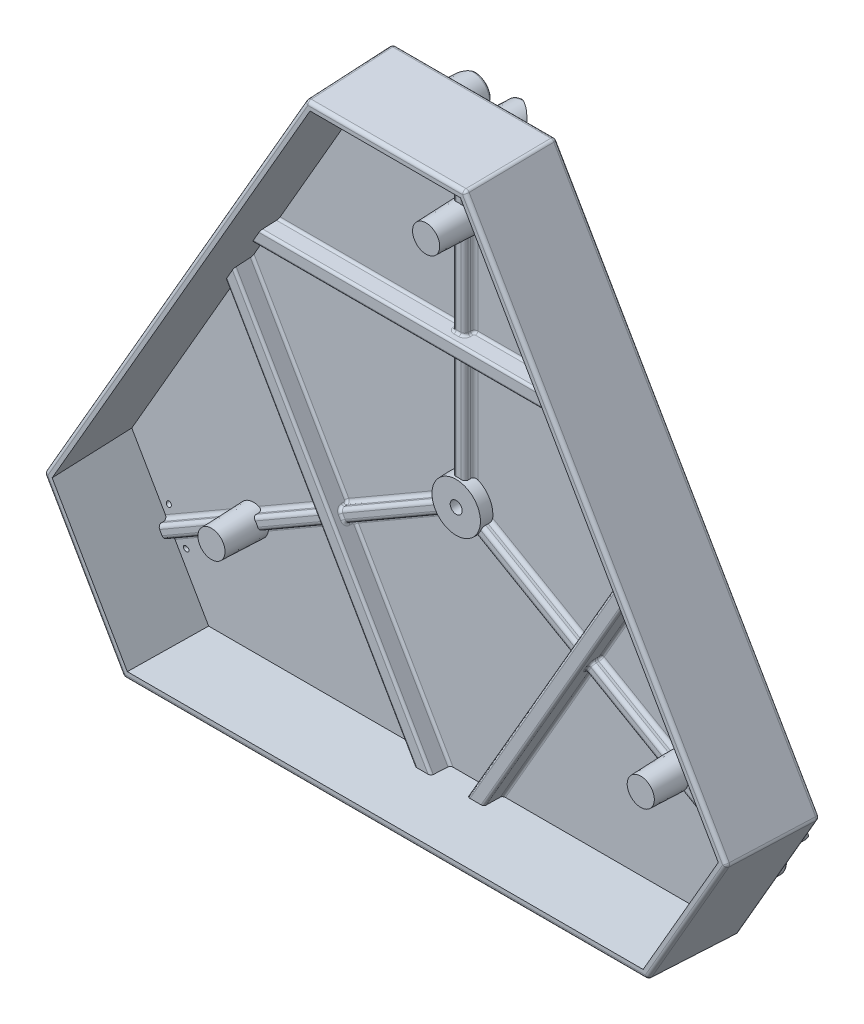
SolidWorks part; units mm, degrees
ref_plane "Plane1" through (0, 0, 0) normal (0, 0, 1) x (1, 0, 0)
ref_plane "Plane2" through (0, 0, 0) normal (0, 1, 0) x (1, 0, 0)
ref_plane "Plane3" through (0, 0, 0) normal (1, 0, 0) x (0, 0, -1)
sketch "Esquisse1" plane through (0, 0, 0) normal (0, 0, 1) x (1, 0, 0)
  line L0 (0, 0) -> (0, 320) construction
  line L1 (0, 0) -> (72.3, 313.1656) construction
  line L2 (67.4853, 292.311) -> (-67.4853, 292.311)
  line L3 (0, 0) -> (-312.2499, -180.2776) construction
  line L4 (0, 0) -> (321.4809, -185.6071) construction
  line L5 (-67.4853, 292.311) -> (-286.8914, -87.7115)
  line L6 (-219.4061, -204.5995) -> (219.4061, -204.5995)
  line L7 (0, 0) -> (-348.1002, -106.4249) construction
  line L8 (-286.8914, -87.7115) -> (-219.4061, -204.5995)
  line L9 (0, 0) -> (259.3987, -241.8932) construction
  line L10 (219.4061, -204.5995) -> (286.8914, -87.7115)
  line L11 (286.8914, -87.7115) -> (67.4853, 292.311)
  point P8 (0, 292.311)
  point P16 (253.1488, -146.1555)
  point P17 (-253.1488, -146.1555)
  dimension "D2" = 13
  dimension "D3" = 120
  dimension "D4" = 120
  dimension "D5" = 13
  dimension "D6" = 13
extrude "Base-Extrusion" add sketch "Esquisse1" along normal blind 75 draft 2
shell "Coque1" thickness 6
fillet "Congé1" radius 3
fillet "Congé2" radius 3
fillet "Congé3" radius 3
fillet "Congé4" radius 3
fillet "Congé5" radius 3
fillet "Congé6" radius 3
fillet "Congé7" radius 3
sketch "Esquisse2" plane through (0, 0, 0) normal (0, 0, -1) x (-1, 0, 0)
  circle A0 centre (0, 0) radius 60
  dimension "D1" = 120
extrude "Boss.-Extru.1" add sketch "Esquisse2" along normal blind 3
sketch "Esquisse3" plane through (0, 0, -3) normal (0, 0, -1) x (-1, 0, 0)
  circle A0 centre (0, 0) radius 5
  dimension "D1" = 10
extrude "Enlèv. mat.-Extru.1" cut sketch "Esquisse3" against normal through all
fillet "Congé8" radius 2
sketch "Esquisse4" plane through (0, 0, 6) normal (0, 0, 1) x (1, 0, 0)
  circle A0 centre (0, 0) radius 20.5
  dimension "D1" = 41
extrude "Boss.-Extru.2" add sketch "Esquisse4" along normal blind 10 draft 2
sketch "Esquisse8" plane through (0, 0, 0) normal (0, 1, 0) x (1, 0, 0)
  line L0 (0, -40) -> (0, 10) construction
  line L1 (-5, -4) -> (-5, -14)
  line L2 (-5, -14) -> (5, -14)
  line L3 (-5, -4) -> (5, -4)
  line L4 (0, 0) -> (-11.1536, 0) construction
  line L5 (5, -4) -> (5, -14)
  point P11 (0, -4)
  point P12 (0, -14)
  dimension "D1" = 10
  dimension "D2" = 5
  dimension "D3" = 4
extrude "Boss.-Extru.3" add sketch "Esquisse8" along normal up to surface (286.1677 mm away)
fillet "Congé10" radius 3
fillet "Congé11" radius 3
sketch "Esquisse9" plane through (0, 0, 6) normal (0, 0, 1) x (1, 0, 0)
  line L0 (0, 0) -> (0, 354.9713) construction
  circle A0 centre (0, 206.069) radius 12.5
  dimension "D1" = 25
extrude "Boss.-Extru.4" add sketch "Esquisse9" along normal blind 35 draft 2
sketch "Esquisse11" plane through (0, 0, 16) normal (0, 0, 1) x (1, 0, 0)
  circle A0 centre (0, 0) radius 5
  dimension "D1" = 10
extrude "Enlèv. mat.-Extru.3" cut sketch "Esquisse11" against normal through all
pattern_circular "Répétition circulaire3" count 3 every 120
sketch "Esquisse12" plane through (0, 0, 0) normal (0, 0, -1) x (-1, 0, 0)
  line L0 (0, 0) -> (0, 310.808) construction
  line L1 (0, 0) -> (22.319, 300.3379) construction
  circle A0 centre (20.2502, 272.5) radius 14.5
  dimension "D2" = 29
  dimension "D1" = 4.25
  dimension "D3" = 272.5
extrude "Boss.-Extru.5" add sketch "Esquisse12" along normal blind 20 draft 2
fillet "Congé12" radius 2
mirror "Symétrie1" about plane through (0, 0, 0) normal (1, 0, 0)
pattern_circular "Répétition circulaire5" count 3 every 120
sketch "Esquisse13" plane through (0, 0, -20) normal (0, 0, -1) x (-1, 0, 0)
  point P0 (20.2502, 272.5)
ref_plane "Plan2" through (-20.2502, 0, 0) normal (1, 0, 0) x (0, 0, -1)
ref_plane "Plan3" through (-146.632, 130.5525, 0) normal (0.7469, -0.665, 0) x (0, 0, -1)
sketch "Esquisse14" plane through (-146.632, 130.5525, 0) normal (0.7469, -0.665, 0) x (0, 0, -1)
  line L0 (20, 190.0564) -> (49.6136, 190.0564) construction
  line L1 (20, 190.0564) -> (20, 153.0726) construction
  line L2 (0, 172.3152) -> (0, 157.2567) construction
  line L3 (1.9302, 190.0564) -> (18.0698, 190.0564) construction
  line L4 (10.4, 187.6689) -> (10.4, 153.0726) construction
  line L5 (25.7569, 210.3405) -> (0.5202, 173.0832)
  line L6 (25.7569, 210.3405) -> (59.5454, 187.4534)
  line L7 (59.5454, 187.4534) -> (34.3087, 150.1961)
  line L8 (34.3087, 150.1961) -> (0.5202, 173.0832)
  line L9 (10.4, 187.6689) -> (37.659, 171.9308) construction
  point P13 (10.4, 187.6689)
  point P15 (12.5, 190.0564)
  point P18 (37.659, 171.9308)
  dimension "D1" = 10.4
  dimension "D2" = 12.5
  dimension "D3" = 30
  dimension "D4" = 40.8103
  dimension "D5" = 45
extrude "Enlèv. mat.-Extru.4" cut sketch "Esquisse14" against normal mid plane 30
sketch "Esquisse16" plane through (-146.632, 130.5525, 0) normal (0.7469, -0.665, 0) x (0, 0, -1)
  line L0 (17.0167, 197.4953) -> (3.4439, 177.4617) construction
  line L1 (-2.3946, 196.4428) -> (13.8546, 185.4339) construction
  point P5 (10.4211, 187.7601)
sketch "Esquisse17" plane through (36.0385, 40.4772, 80.0098) normal (-0.3729, -0.4189, -0.8279) x (-0.9279, 0.1683, 0.3328)
  circle A0 centre (62.3243, 246.3286) radius 10
  dimension "D1" = 20
extrude "Enlèv. mat.-Extru.5" cut sketch "Esquisse17" against normal blind 8
sketch "Esquisse18" plane through (39.0219, 43.828, 86.6333) normal (-0.3729, -0.4189, -0.8279) x (-0.9279, 0.1683, 0.3328)
  circle A0 centre (62.3243, 246.3286) radius 2
  dimension "D1" = 4
extrude "Enlèv. mat.-Extru.6" cut sketch "Esquisse18" against normal up to next
mirror "Symétrie2" about plane through (0, 0, 0) normal (1, 0, 0)
pattern_circular "Répétition circulaire7" count 3 every 120
pattern_circular "Répétition circulaire10" count 3 every 120
ref_plane "Plan4" through (0, 118, 0) normal (0, 1, 0) x (-1, 0, 0)
sketch "Esquisse20" plane through (0, 0, 0) normal (1, 0, 0) x (0, 0, -1)
  line L0 (-22, 0) -> (-87.1499, 0) construction
  line L1 (-16, 0) -> (3, 0) construction
  line L2 (-14, 118) -> (-102.5732, 118) construction
  line L3 (-14, 20.1215) -> (-14, 194.0131) construction
  line L4 (-22, 124) -> (-22, 112)
  line L5 (-22, 112) -> (-2, 112)
  line L7 (-2, 124) -> (-2, 112)
  line L8 (-14, 118) -> (-14, 104.315) construction
  line L9 (-22, 124) -> (-2, 124)
  point P14 (-2, 118)
  point P16 (-22, 118)
  dimension "D1" = 118
  dimension "D3" = 8
  dimension "D4" = 20
extrude "Boss.-Extru.6" add sketch "Esquisse20" along normal up to surface (156.8402 mm away)
mirror "Symétrie4" about plane through (0, 0, 0) normal (1, 0, 0)
fillet "Congé13" radius 2
fillet "Congé14" radius 2
mirror "Symétrie5" about plane through (0, 0, 0) normal (1, 0, 0)
pattern_circular "Répétition circulaire11" count 3 every 120
